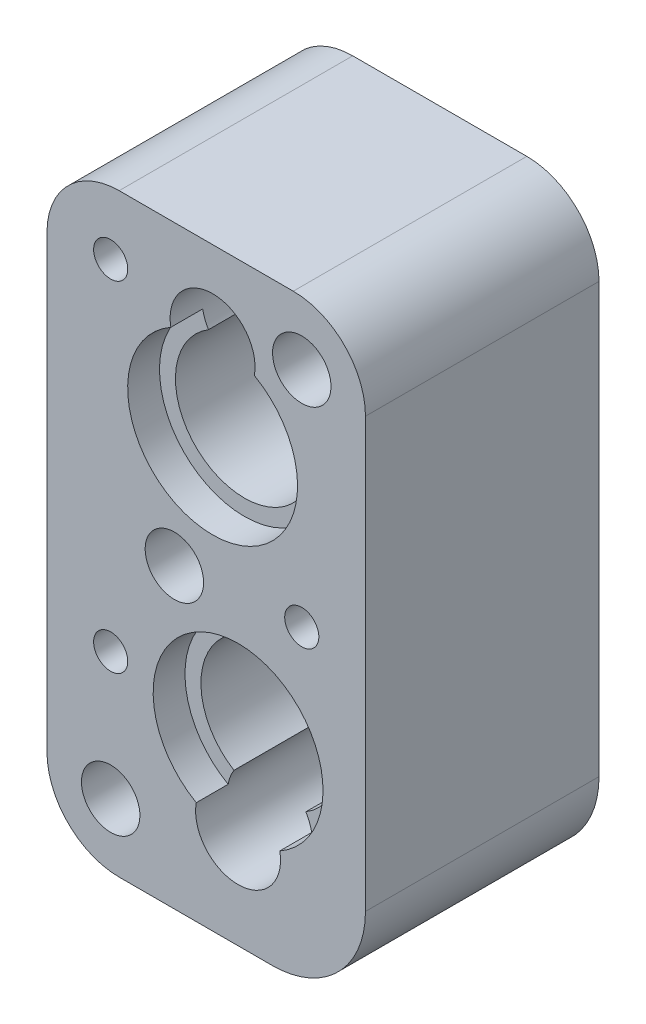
SolidWorks part; units mm, degrees
ref_plane "Front" through (0, 0, 0) normal (0, 0, 1) x (1, 0, 0)
ref_plane "Top" through (0, 0, 0) normal (0, 1, 0) x (1, 0, 0)
ref_plane "Right" through (0, 0, 0) normal (1, 0, 0) x (0, 0, -1)
ref_plane "Plane1"
sketch "Sketch1" plane through (0, 0, 40.2082) normal (0, 0, -1) x (-1, 0, 0)
  line L1 (121.92, 88.5952) -> (147.955, 88.5952)
  line L2 (111.125, 77.8002) -> (111.125, 13.6652)
  line L3 (125.095, -0.3048) -> (147.955, -0.3048)
  line L4 (158.75, 77.8002) -> (158.75, 10.4902)
  arc A3 (147.955, -0.3048) -> (158.75, 10.4902) centre (147.955, 10.4902) ccw
  arc A4 (121.92, 88.5952) -> (111.125, 77.8002) centre (121.92, 77.8002) ccw
  arc A5 (111.125, 13.6652) -> (125.095, -0.3048) centre (125.095, 13.6652) ccw
  arc A7 (147.955, 88.5952) -> (158.75, 77.8002) centre (147.955, 77.8002) cw
  point P10 (158.75, 88.5952)
  point P15 (111.125, 88.5952)
  point P18 (111.125, -0.3048)
extrude "Boss-Extrude1" add sketch "Sketch1" against normal blind 31.75 and the other way blind 3.175 flip side to cut
hole_wizard "Hole1" positions "Point_Sketch" profile "Profil_Sketch" hole size "Ø0.15" standard "ISO"
sketch "Point_Sketch" plane through (-122.7107, 32.8261, 37.0332) normal (0, 0, 1) x (-1, 0, 0)
  point P0 (11.2743, -43.0691)
  point P2 (7.4643, 18.8561)
sketch "Profil_Sketch" plane through (-133.985, 75.8952, 37.0332) normal (1, 0, 0) x (0, 1, 0)
  line L0 (0, 0) -> (0, 34.925)
  line L1 (0, 34.925) -> (6.35, 34.925)
  line L2 (6.35, 34.925) -> (6.35, 0)
  line L5 (6.35, 0) -> (0, 0)
  line L11 (0, -6.35) -> (0, 107.95) construction
  dimension "Diameter" = 12.7
  dimension "Thru Hole Depth" = 34.925
other "usin_DL090<1>"
hole_wizard "Hole11" positions "Point_Sketch1" profile "Profil_Sketch1" counterbore size "1/4" standard "ANSI Inch"
sketch "Point_Sketch1" plane through (-130.6131, 31.781, 71.9582) normal (0, 0, -1) x (1, 0, 0)
  point P0 (-3.3719, -31.9222)
sketch "Profil_Sketch1" plane through (-133.985, 63.7032, 71.9582) normal (1, 0, 0) x (0, -1, 0)
  line L0 (0, 0) -> (0, 34.925)
  line L1 (0, 34.925) -> (10.3187, 34.925)
  line L3 (10.3187, 34.925) -> (10.3188, 4.7625)
  line L4 (10.3188, 4.7625) -> (12.7, 4.7625)
  line L5 (12.7, 4.7625) -> (12.7, 0)
  line L7 (12.7, 0) -> (0, 0)
  line L11 (0, -6.35) -> (0, 107.95) construction
  dimension "Diameter" = 20.6375
  dimension "Thru Hole Depth" = 34.925
  dimension "L1" = 4.7625
other "usin_LS160<1>"
hole_wizard "Hole12" positions "Point_Sketch2" profile "Profil_Sketch2" counterbore size "1/4" standard "ANSI Inch"
sketch "Point_Sketch2" plane through (-103.5347, 68.9613, 71.9582) normal (0, 0, -1) x (1, 0, 0)
  point P0 (-26.6403, 42.7993)
sketch "Profil_Sketch2" plane through (-130.175, 26.162, 71.9582) normal (1, 0, 0) x (0, -1, 0)
  line L0 (0, 0) -> (0, 34.925)
  line L1 (0, 34.925) -> (10.3187, 34.925)
  line L3 (10.3187, 34.925) -> (10.3188, 4.7625)
  line L4 (10.3188, 4.7625) -> (12.7, 4.7625)
  line L5 (12.7, 4.7625) -> (12.7, 0)
  line L7 (12.7, 0) -> (0, 0)
  line L11 (0, -6.35) -> (0, 107.95) construction
  dimension "Diameter" = 20.6375
  dimension "Thru Hole Depth" = 34.925
  dimension "L1" = 4.7625
other "usin_LS160<2>"
hole_wizard "Hole15" positions "Point_Sketch5" profile "Profil_Sketch5" tap size "1/4-20" standard "ANSI Inch"
sketch "Point_Sketch5" plane through (-140.5785, 62.584, 71.9582) normal (0, 0, 1) x (1, 0, 0)
  point P0 (-8.6465, -34.3138)
  point P2 (19.9285, -16.8513)
  point P4 (-8.6465, 16.4862)
sketch "Profil_Sketch5" plane through (-149.225, 28.2702, 71.9582) normal (1, 0, 0) x (0, -1, 0)
  line L0 (0, 0) -> (0, 36.4588)
  line L1 (0, 36.4588) -> (2.5527, 34.925)
  line L2 (2.5527, 34.925) -> (2.5527, 0)
  line L5 (2.5527, 0) -> (0, 0)
  line L10 (0, 36.4588) -> (-2.5527, 34.925) construction
  line L11 (0, -6.35) -> (0, 107.95) construction
  dimension "Tap Drill Dia." = 5.1054
  dimension "Tap Drill Depth" = 34.925
  dimension "Drill Angle" = 118
other "usin_DT360_.25-20x.625-SHCS<1>"
hole_wizard "Hole16" positions "Point_Sketch6" profile "Profil_Sketch6" counterbore size "1/4" standard "ANSI Inch"
sketch "Point_Sketch6" plane through (-107.7809, 80.0052, 37.0332) normal (0, 0, 1) x (-1, 0, 0)
  point P0 (12.8691, 0.935)
  point P2 (31.9191, 35.86)
  point P4 (41.4441, 70.785)
sketch "Profil_Sketch6" plane through (-120.65, 79.0702, 37.0332) normal (1, 0, 0) x (0, 1, 0)
  line L0 (0, 0) -> (0, 34.925)
  line L1 (0, 34.925) -> (4.3688, 34.925)
  line L3 (4.3688, 34.925) -> (4.3688, 9.652)
  line L4 (4.3688, 9.652) -> (6.5405, 9.652)
  line L5 (6.5405, 9.652) -> (6.5405, 0)
  line L7 (6.5405, 0) -> (0, 0)
  line L11 (0, -6.35) -> (0, 107.95) construction
  dimension "Diameter" = 8.7376
  dimension "Thru Hole Depth" = 34.925
  dimension "L1" = 9.652
other "usin_LS160_.3125-18x2-SHCS<3>"
